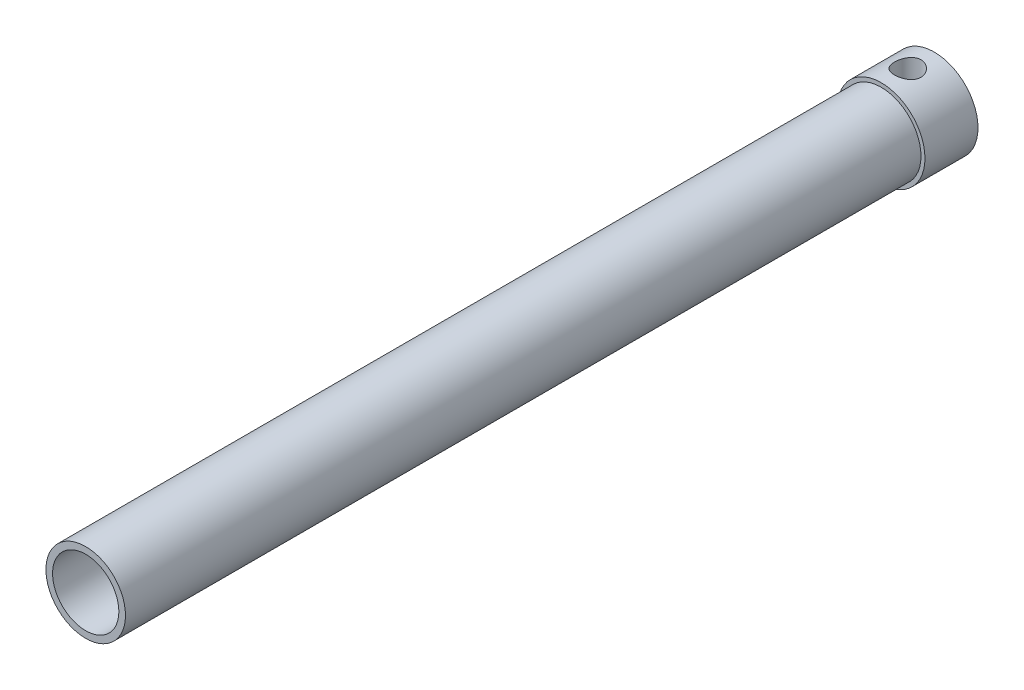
SolidWorks part; units mm, degrees
ref_plane "Front Plane" through (0, 0, 0) normal (0, 0, 1) x (1, 0, 0)
ref_plane "Top Plane" through (0, 0, 0) normal (0, 1, 0) x (1, 0, 0)
ref_plane "Right Plane" through (0, 0, 0) normal (1, 0, 0) x (0, 0, -1)
sketch "Sketch2" plane through (0, 0, 0) normal (0, 0, 1) x (1, 0, 0)
  circle A0 centre (0, 0) radius 15
  dimension "D1" = 30
extrude "Boss-Extrude1" add sketch "Sketch2" along normal blind 300
sketch "Sketch3" plane through (0, 0, 0) normal (0, 0, 1) x (1, 0, 0)
  circle A0 centre (0, 0) radius 16.5
  dimension "D1" = 33
extrude "Boss-Extrude2" add sketch "Sketch3" against normal blind 20
sketch "Sketch4" plane through (0, 0, 300) normal (0, 0, 1) x (1, 0, 0)
  circle A0 centre (0, 0) radius 12.5
  dimension "D1" = 25
extrude "Cut-Extrude1" cut sketch "Sketch4" against normal blind 75
ref_plane "Plane2" through (0, 17, 0) normal (0, 1, 0) x (1, 0, 0)
sketch "Sketch7" plane through (0, 17, 0) normal (0, 1, 0) x (1, 0, 0)
  circle A0 centre (0, 10) radius 5
  dimension "D1" = 10
  dimension "D2" = 10
extrude "Cut-Extrude2" cut sketch "Sketch7" against normal blind 17
